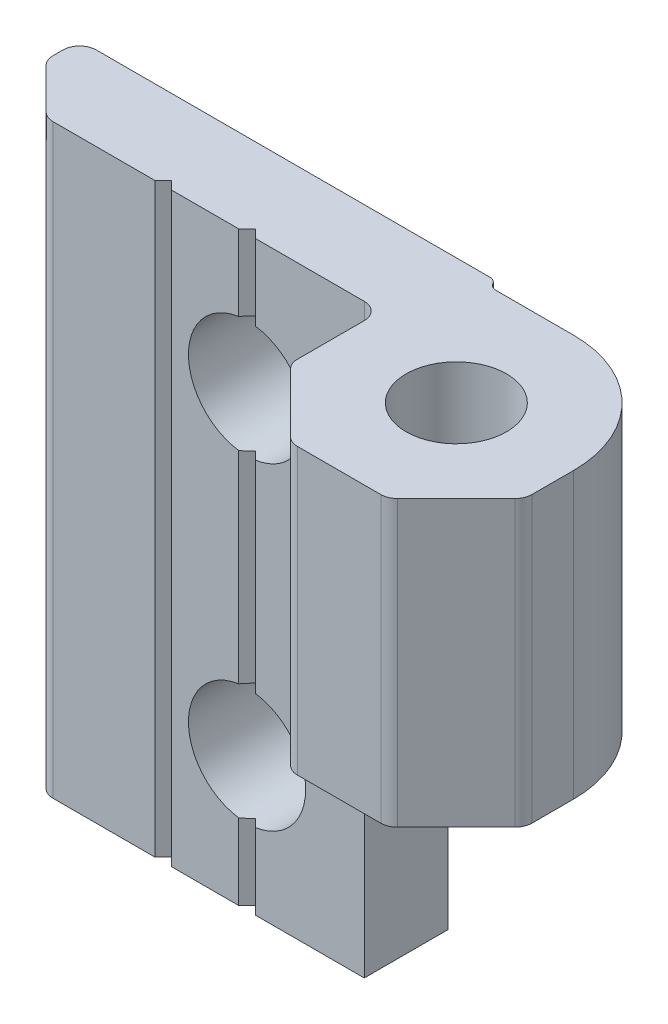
SolidWorks part; units mm, degrees
ref_plane "正面" through (0, 0, 0) normal (0, 0, 1) x (1, 0, 0)
ref_plane "平面" through (0, 0, 0) normal (0, 1, 0) x (1, 0, 0)
ref_plane "右側面" through (0, 0, 0) normal (1, 0, 0) x (0, 0, -1)
sketch "ｽｹｯﾁ1" plane through (0, 0, 0) normal (0, 1, 0) x (1, 0, 0)
  line L0 (-30, 5.9142) -> (-30, 6.5)
  line L1 (-29.7071, 5.2071) -> (-27.2929, 2.7929)
  line L2 (-19.5, 2.5) -> (-15.5, 2.5)
  line L3 (-15, 3) -> (-15.5, 2.5)
  line L4 (-15, 3) -> (-14.5, 2.5)
  line L5 (-20, 3) -> (-19.5, 2.5)
  line L6 (-20, 3) -> (-20.5, 2.5)
  line L7 (-7, -2.4853) -> (-7, 1.5)
  line L8 (-14.5, 2.5) -> (-8, 2.5)
  line L9 (0, 7) -> (-4.634, 7)
  line L10 (7, 0) -> (7, -2.4853)
  line L11 (2.4853, -7) -> (-2.4853, -7)
  line L12 (6.7071, -3.1924) -> (3.1924, -6.7071)
  line L13 (-3.1924, -6.7071) -> (-6.7071, -3.1924)
  line L14 (-29, 7.5) -> (-5.5, 7.5)
  line L15 (-26.5858, 2.5) -> (-20.5, 2.5)
  arc A0 (-27.2929, 2.7929) -> (-26.5858, 2.5) centre (-26.5858, 3.5) ccw
  arc A1 (-29, 7.5) -> (-30, 6.5) centre (-29, 6.5) ccw
  arc A2 (-30, 5.9142) -> (-29.7071, 5.2071) centre (-29, 5.9142) ccw
  arc A3 (-7, 1.5) -> (-8, 2.5) centre (-8, 1.5) ccw
  arc A4 (-7, -2.4853) -> (-6.7071, -3.1924) centre (-6, -2.4853) ccw
  arc A5 (-5.067, 7.25) -> (-4.634, 7) centre (-4.634, 7.5) ccw
  arc A6 (7, 0) -> (0, 7) centre (0, 0) ccw
  arc A7 (-3.1924, -6.7071) -> (-2.4853, -7) centre (-2.4853, -6) ccw
  arc A8 (2.4853, -7) -> (3.1924, -6.7071) centre (2.4853, -6) ccw
  circle A9 centre (0, 0) radius 3
  arc A10 (6.7071, -3.1924) -> (7, -2.4853) centre (6, -2.4853) ccw
  arc A11 (-5.067, 7.25) -> (-5.5, 7.5) centre (-5.5, 7) ccw
extrude "ﾎﾞｽ - 押し出し1" add sketch "ｽｹｯﾁ1" along normal blind 35
sketch "ｽｹｯﾁ2" plane through (0, 0, -7.5) normal (0, 0, -1) x (-1, 0, 0)
  line L0 (5.5, 0) -> (29, 0) construction
  line L1 (-17.8242, -7.1923) -> (8, -7.1923)
  line L2 (-17.8242, -7.1923) -> (-17.8242, 18)
  line L3 (-17.8242, 18) -> (8, 18)
  line L4 (8, -7.1923) -> (8, 18)
  line L5 (-7, 35) -> (-7, 0) construction
  dimension "D1" = 18
  dimension "D2" = 15
extrude "ｶｯﾄ - 押し出し1" cut sketch "ｽｹｯﾁ2" against normal blind 35
hole_wizard "Ø7.0 (7) 直径の穴1" positions "3Dｽｹｯﾁ1" profile "ｽｹｯﾁ3" hole size "Ø7.0" standard "Jis"
sketch3d "3Dｽｹｯﾁ1"
  line L0 (-26.5858, 35, -2.5) -> (-20.5, 35, -2.5) construction
  line L1 (-8, 0, -2.5) -> (-8, 18, -2.5) construction
  point P0 (-15, 27, -2.5)
  point P2 (-15, 8, -2.5)
  dimension "D1" = 8
  dimension "D2" = 19
  dimension "D3" = 7
sketch "ｽｹｯﾁ3" plane through (-15, 27, -2.5) normal (1, 0, 0) x (0, -1, 0)
  line L0 (0, 0) -> (0, 32.103)
  line L1 (0, 32.103) -> (3.5, 30)
  line L2 (3.5, 30) -> (3.5, 0)
  line L5 (3.5, 0) -> (0, 0)
  line L10 (0, 32.103) -> (-3.5, 30) construction
  line L11 (0, -6.35) -> (0, 107.95) construction
  dimension "穴の直径" = 7
  dimension "穴の深さ" = 30
  dimension "ﾄﾞﾘﾙ角度" = 118
